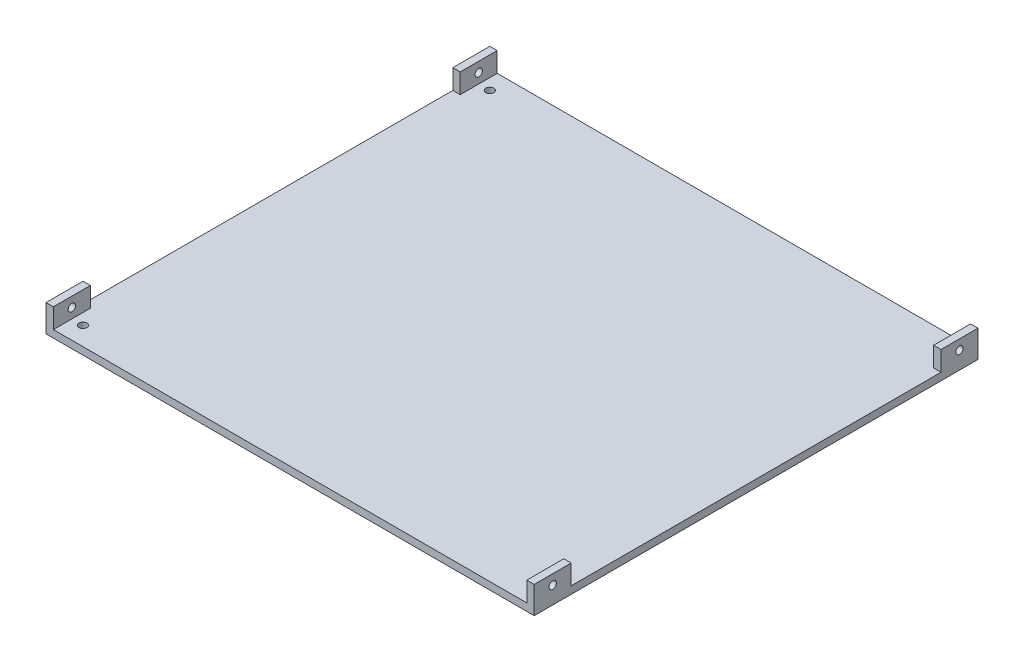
SolidWorks part; units mm, degrees
ref_plane "前视基准面" through (0, 0, 0) normal (0, 0, 1) x (1, 0, 0)
ref_plane "上视基准面" through (0, 0, 0) normal (0, 1, 0) x (1, 0, 0)
ref_plane "右视基准面" through (0, 0, 0) normal (1, 0, 0) x (0, 0, -1)
sketch "草图1" plane through (0, 0, 0) normal (0, 1, 0) x (1, 0, 0)
  line L0 (-186.9297, 0) -> (238.1693, 0) construction
  line L1 (-99, 90) -> (99, 90)
  line L2 (-99, 90) -> (-99, -90)
  line L3 (-99, -90) -> (99, -90)
  line L4 (99, 90) -> (99, -90)
  line L5 (-99, 90) -> (99, -90) construction
  line L6 (-99, -90) -> (99, 90) construction
  line L7 (0, 189.3968) -> (0, -184.8422) construction
  circle A0 centre (-91.5, 82.5) radius 1.6
  circle A1 centre (91.5, 82.5) radius 1.6
  circle A2 centre (91.5, -82.5) radius 1.6
  circle A3 centre (-91.5, -82.5) radius 1.6
  point P0 (0, 0)
  dimension "D3" = 3.2
  dimension "D1" = 198
  dimension "D2" = 180
  dimension "D4" = 7.5
  dimension "D5" = 7.5
extrude "凸台-拉伸1" add sketch "草图1" against normal blind 3
sketch "草图2" plane through (0, 0, 0) normal (0, 1, 0) x (1, 0, 0)
  line L0 (99, 90) -> (-99, 90) construction
  line L1 (99, 90) -> (-99, 90) construction
  line L2 (-99, 90) -> (-99, -90) construction
  line L3 (-99, 90) -> (-99, -90) construction
  line L4 (-132.9072, 0) -> (133.2886, 0) construction
  line L5 (-99, 90) -> (-96, 90)
  line L6 (-99, 90) -> (-99, 75)
  line L7 (-99, 75) -> (-96, 75)
  line L8 (-96, 90) -> (-96, 75)
  line L9 (0, 95.533) -> (0, -102.779) construction
  line L23 (96, 90) -> (96, 75)
  line L24 (99, 75) -> (96, 75)
  line L25 (99, 90) -> (99, 75)
  line L26 (99, 90) -> (96, 90)
  line L35 (99, -90) -> (96, -90)
  line L36 (99, -90) -> (99, -75)
  line L37 (99, -75) -> (96, -75)
  line L38 (96, -90) -> (96, -75)
  line L39 (-96, -90) -> (-96, -75)
  line L40 (-99, -75) -> (-96, -75)
  line L41 (-99, -90) -> (-99, -75)
  line L42 (-99, -90) -> (-96, -90)
  dimension "D1" = 15
  dimension "D2" = 3
extrude "凸台-拉伸2" add sketch "草图2" along normal blind 8
sketch "草图3" plane through (0, 0, 0) normal (1, 0, 0) x (0, 0, -1)
  line L0 (-94.5672, 4) -> (-14.9413, 4) construction
  line L1 (0, 50.2704) -> (0, -66.5568) construction
  circle A0 centre (-82.5, 4) radius 1.5
  circle A1 centre (82.5, 4) radius 1.5
  dimension "D2" = 3
  dimension "D1" = 4
  dimension "D3" = 82.5
extrude "切除-拉伸1" cut sketch "草图3" against normal through all both and the other way through all
